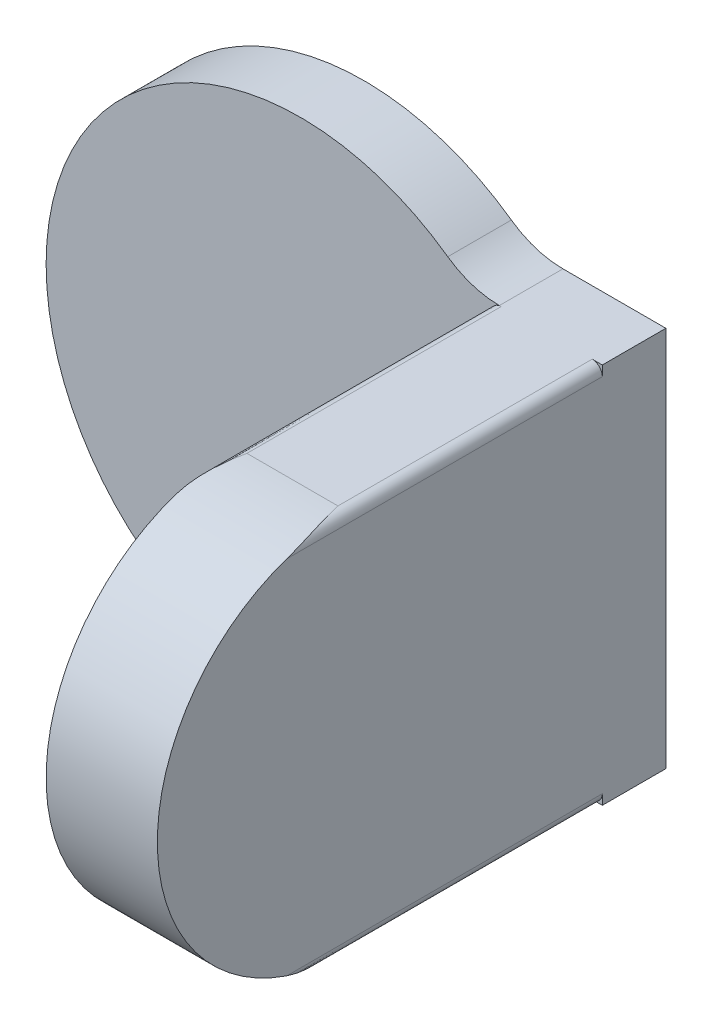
SolidWorks part; units mm, degrees
ref_plane "Front" through (0, 0, 0) normal (0, 0, 1) x (1, 0, 0)
ref_plane "Top" through (0, 0, 0) normal (0, 1, 0) x (1, 0, 0)
ref_plane "Right" through (0, 0, 0) normal (1, 0, 0) x (0, 0, -1)
sketch "Sketch1" plane through (0, 0, 0) normal (0, 0, 1) x (1, 0, 0)
  line L0 (47.5, 0) -> (0, 0) construction
  line L1 (31.305, 30) -> (47.5, 30)
  line L3 (31.305, -30) -> (47.5, -30)
  line L4 (47.5, 30) -> (47.5, -30)
  arc A0 (23.1889, 32.5926) -> (23.1889, -32.5926) centre (0, 0) ccw
  arc A1 (23.1889, -32.5926) -> (31.305, -30) centre (31.305, -44) cw
  arc A2 (31.305, 30) -> (23.1889, 32.5926) centre (31.305, 44) cw
  dimension "D1" = 80
  dimension "D2" = 14
  dimension "D3" = 47.5
  dimension "D4" = 60
extrude "Extrude1" add sketch "Sketch1" along normal blind 10
sketch "Sketch3" plane through (47.5, 0, 0) normal (1, 0, 0) x (0, 0, -1)
  line L0 (0, 30) -> (-50, 30)
  line L1 (-50, -30) -> (0, -30)
  line L2 (0, -30) -> (0, 30) construction
  line L3 (-10, -30) -> (0, -30) construction
  line L4 (0, 30) -> (0, -30)
  arc A0 (-50, 30) -> (-50, -30) centre (-50, 0) ccw
  dimension "D1" = 50
extrude "Extrude2" add sketch "Sketch3" against normal blind 17.5
sketch "Sketch4" plane through (0, 0, 10) normal (0, 0, 1) x (1, 0, 0)
  line L0 (38.75, 30) -> (38.75, 25.8015) construction
  line L1 (45.91, 30) -> (47.5, 30)
  line L2 (47.5, 30) -> (47.5, 28.41)
  line L3 (30, 30) -> (30, 28.41)
  line L4 (30, 30) -> (47.5, 30) construction
  line L5 (47.5, -30) -> (47.5, 30) construction
  line L7 (31.59, 30) -> (30, 30)
  line L8 (47.5, 0) -> (40.7672, 0) construction
  line L9 (31.59, -30) -> (30, -30)
  line L10 (30, -30) -> (30, -28.41)
  line L11 (47.5, -30) -> (47.5, -28.41)
  line L12 (45.91, -30) -> (47.5, -30)
  arc A0 (47.5, 28.41) -> (45.91, 30) centre (45.91, 28.41) ccw
  arc A1 (30, 28.41) -> (31.59, 30) centre (31.59, 28.41) cw
  arc A2 (30, -28.41) -> (31.59, -30) centre (31.59, -28.41) ccw
  arc A3 (47.5, -28.41) -> (45.91, -30) centre (45.91, -28.41) cw
  dimension "D1" = 1.59
extrude "Cut-Extrude1" cut sketch "Sketch4" along normal through all
